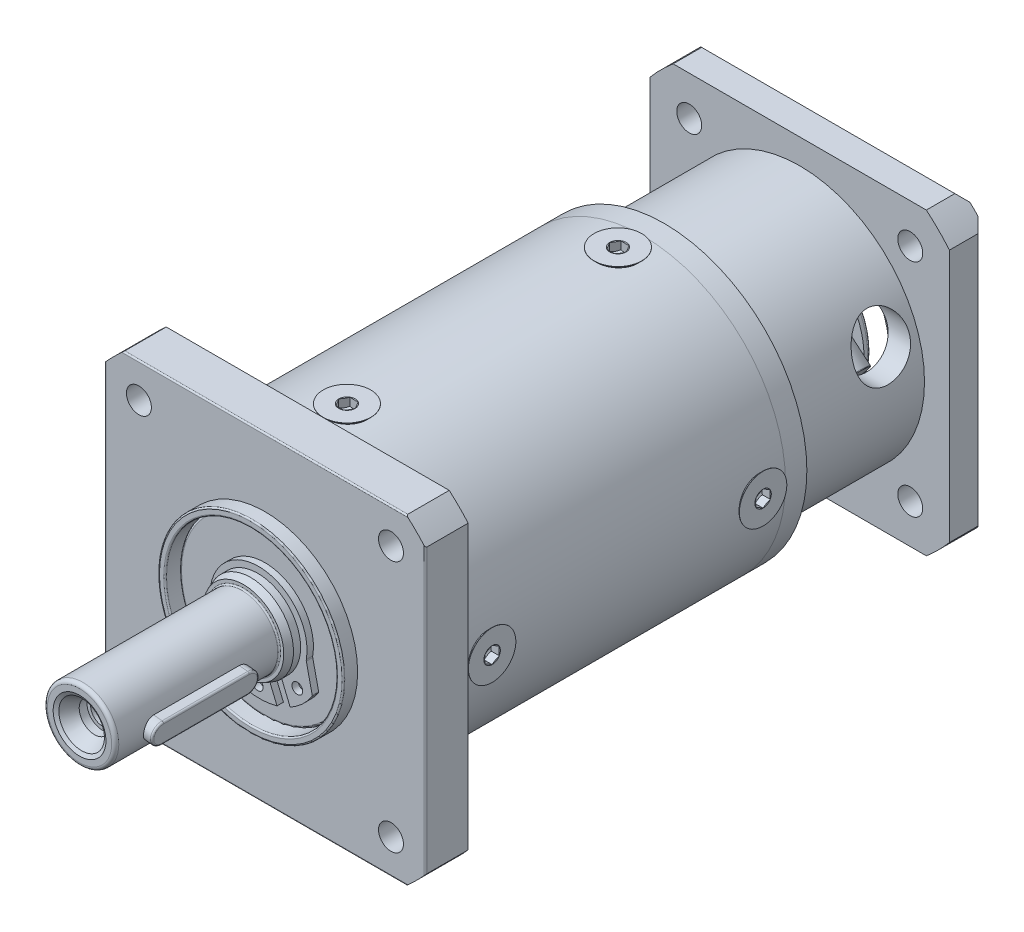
SolidWorks part; units mm, degrees
other "³ÁÍ·ÂÝ¶¤M3¡Á6-8-solid1"
other "µ¯µæ-1-solid1"
other "PL40.070.5-25-22-¿Ú31-%c3.5£¨61802Öá³Ð£©-1-solid1"
other "ÇÐ³ý-À Éì1[3]"
other "Éî¹µÇòÖá³Ð60000ÐÍ19ÏµÁÐ-1-solid1"
other "³ÁÍ·ÂÝ¶¤M3¡Á6-2-solid1"
other "³ÁÍ·ÂÝ¶¤M3¡Á6-5-solid1"
other "³ÁÍ·ÂÝ¶¤M3¡Á6-3-solid1"
other "³ÁÍ·ÂÝ¶¤M3¡Á6-6-solid1"
other "³ÁÍ·ÂÝ¶¤M3¡Á6-7-solid1"
other "ÇÐ³ý-À Éì1[1]"
other "Éî¹µÇòÖá³Ð60000ÐÍ18ÏµÁÐ-3-solid2"
other "Éî¹µÇòÖá³Ð60000ÐÍ18ÏµÁÐ-3-solid1"
other "ÖáÓÃµ¯ÐÔµ²È¦AÐÍ£¨¡Ý10£©-1-solid1"
other "12.9-ÄÚÁù½ÇÔ²ÖùÍ·ÂÝ¶¤-M4-1-solid1"
other "ÇÐ³ý-À Éì1[2]"
other "Éî¹µÇòÖá³Ð60000ÐÍ19ÏµÁÐ-2-solid1"
other "Éî¹µÇòÖá³Ð60000ÐÍ18ÏµÁÐ-3-solid5"
other "¿×ÓÃµ¯ÐÔµ²È¦AÐÍ-2-solid1"
other "Éî¹µÇòÖá³Ð60000ÐÍ18ÏµÁÐ-3-solid3"
other "Éî¹µÇòÖá³Ð60000ÐÍ18ÏµÁÐ-3-solid4"
other "PF40.090-1-solid1"
other "ÆÕÍ¨Æ½¼üAÐÍ A3-1-solid1"
other "³ÁÍ·ÂÝ¶¤M3¡Á6-4-solid1"
other "³ÁÍ·ÂÝ¶¤M3¡Á6-1-solid1"
other "PL40.040.05-05-1-solid1"
other "¿×ÓÃµ¯ÐÔµ²È¦AÐÍ-1-solid1"
ref_plane "Front Plane" through (0, 0, 0) normal (0, 0, 1) x (1, 0, 0)
ref_plane "Top Plane" through (0, 0, 0) normal (0, 1, 0) x (1, 0, 0)
ref_plane "Right Plane" through (0, 0, 0) normal (1, 0, 0) x (0, 0, -1)
imported_body "Imported1"
imported_body "Imported2"
imported_body "Imported3"
imported_body "Imported4"
imported_body "Imported5"
imported_body "Imported6"
imported_body "Imported7"
imported_body "Imported8"
imported_body "Imported9"
imported_body "Imported10"
imported_body "Imported11"
imported_body "Imported12"
imported_body "Imported13"
imported_body "Imported14"
imported_body "Imported15"
imported_body "Imported16"
imported_body "Imported17"
imported_body "Imported18"
imported_body "Imported19"
imported_body "Imported20"
imported_body "Imported21"
imported_body "Imported22"
imported_body "Imported23"
imported_body "Imported24"
imported_body "Imported25"
imported_body "Imported26"
imported_body "Imported27"
sketch "Sketch1" plane through (0, 0, 46.25) normal (0, 0, 1) x (1, 0, 0)
  circle A0 centre (-4.8099, 13.8621) radius 10.3
  circle A1 centre (-4.8099, 13.8621) radius 10.3 construction
  circle A2 centre (-4.8099, 13.8621) radius 7.75
  circle A3 centre (-4.8099, 13.8621) radius 7.75 construction
extrude "Boss-Extrude1" add sketch "Sketch1" against normal blind 0.5
